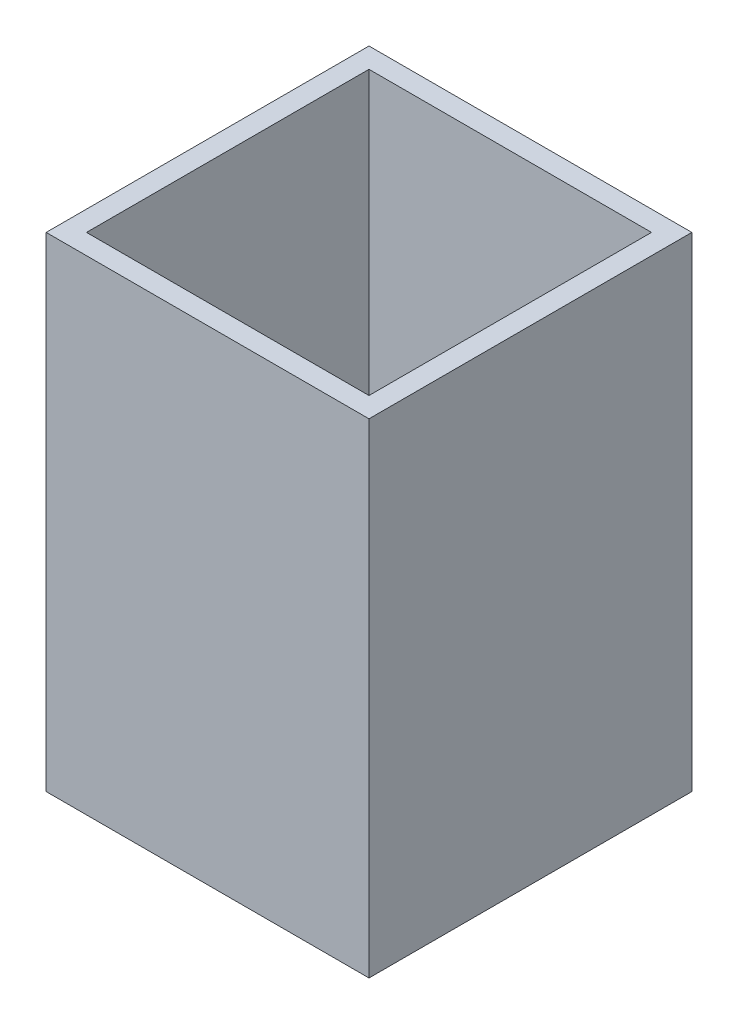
SolidWorks part; units mm, degrees
ref_plane "Front Plane" through (0, 0, 0) normal (0, 0, 1) x (1, 0, 0)
ref_plane "Top Plane" through (0, 0, 0) normal (0, 1, 0) x (1, 0, 0)
ref_plane "Right Plane" through (0, 0, 0) normal (1, 0, 0) x (0, 0, -1)
ref_plane "Plane1" through (0, 76.2, 0) normal (0, 1, 0) x (-1, 0, 0)
sketch "Sketch1" plane through (0, 76.2, 0) normal (0, 1, 0) x (-1, 0, 0)
  line L0 (-90.3275, 23.5625) -> (-90.3275, -27.2375)
  line L1 (-90.3275, -27.2375) -> (-39.5275, -27.2375)
  line L2 (-39.5275, -27.2375) -> (-39.5275, 23.5625)
  line L3 (-39.5275, 23.5625) -> (-90.3275, 23.5625)
  line L4 (-87.1525, -24.0625) -> (-87.1525, 20.3875)
  line L5 (-87.1525, 20.3875) -> (-42.7025, 20.3875)
  line L6 (-42.7025, 20.3875) -> (-42.7025, -24.0625)
  line L7 (-42.7025, -24.0625) -> (-87.1525, -24.0625)
extrude "Boss-Extrude1" add sketch "Sketch1" against normal blind 76.2
